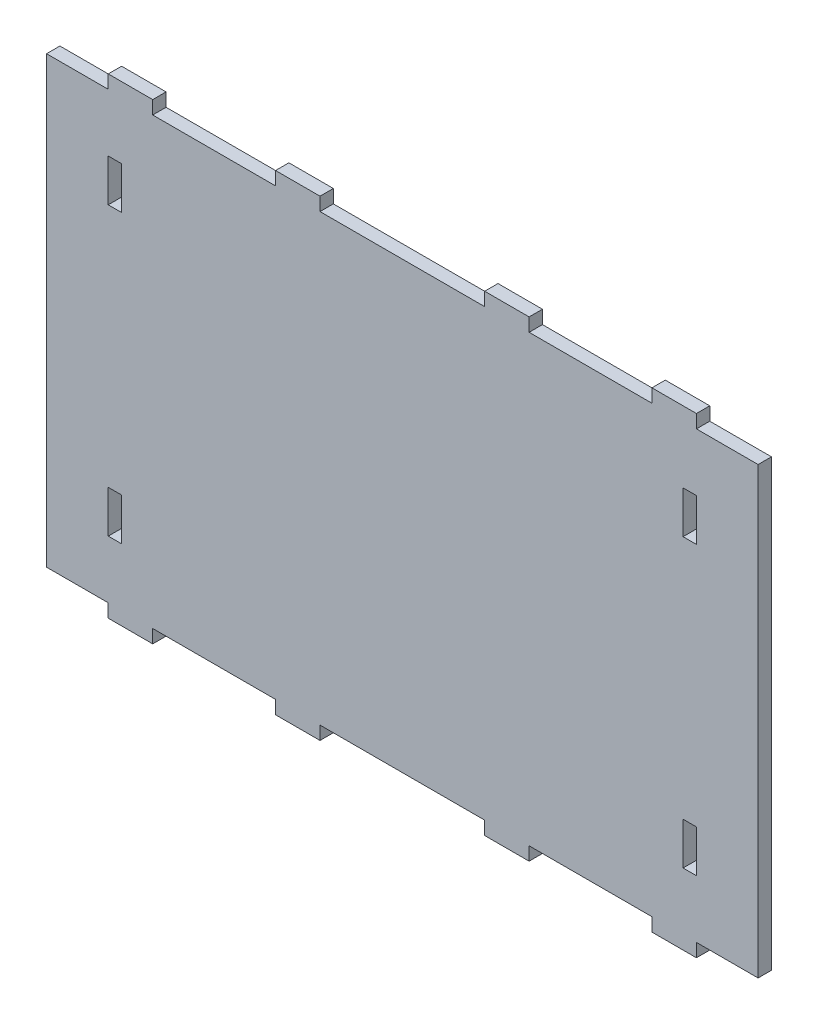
SolidWorks part; units mm, degrees
ref_plane "Plan de face" through (0, 0, 0) normal (0, 0, 1) x (1, 0, 0)
ref_plane "Plan de dessus" through (0, 0, 0) normal (0, 1, 0) x (1, 0, 0)
ref_plane "Plan de droite" through (0, 0, 0) normal (1, 0, 0) x (0, 0, -1)
sketch "Esquisse1" plane through (0, 0, 0) normal (0, 0, 1) x (1, 0, 0)
  line L0 (-80, 0) -> (-66.1305, 0)
  line L1 (-66.1305, 0) -> (-66.1305, -3)
  line L2 (-66.1305, -3) -> (-56.1305, -3)
  line L3 (-56.1305, -3) -> (-56.1305, 0)
  line L4 (-56.1305, 0) -> (-28.5112, 0)
  line L5 (-28.5112, 0) -> (-28.5112, -3)
  line L6 (-28.5112, -3) -> (-18.5112, -3)
  line L7 (-18.5112, -3) -> (-18.5112, 0)
  line L8 (-18.5112, 0) -> (18.5112, 0)
  line L9 (0, 26.5232) -> (0, -22.5938) construction
  line L10 (18.5112, -3) -> (18.5112, 0)
  line L11 (28.5112, -3) -> (18.5112, -3)
  line L12 (28.5112, 0) -> (28.5112, -3)
  line L13 (56.1305, 0) -> (28.5112, 0)
  line L14 (56.1305, -3) -> (56.1305, 0)
  line L15 (66.1305, -3) -> (56.1305, -3)
  line L16 (66.1305, 0) -> (66.1305, -3)
  line L17 (80, 0) -> (66.1305, 0)
  line L18 (-80, 0) -> (-80, 100)
  line L19 (-80, 50) -> (80, 50) construction
  line L20 (80, 100) -> (80, 0)
  line L21 (80, 100) -> (66.1305, 100)
  line L22 (66.1305, 100) -> (66.1305, 103)
  line L23 (66.1305, 103) -> (56.1305, 103)
  line L24 (56.1305, 103) -> (56.1305, 100)
  line L25 (56.1305, 100) -> (28.5112, 100)
  line L26 (28.5112, 100) -> (28.5112, 103)
  line L27 (28.5112, 103) -> (18.5112, 103)
  line L28 (18.5112, 103) -> (18.5112, 100)
  line L29 (-18.5112, 100) -> (18.5112, 100)
  line L30 (-18.5112, 103) -> (-18.5112, 100)
  line L31 (-28.5112, 103) -> (-18.5112, 103)
  line L32 (-28.5112, 100) -> (-28.5112, 103)
  line L33 (-56.1305, 100) -> (-28.5112, 100)
  line L34 (-56.1305, 103) -> (-56.1305, 100)
  line L35 (-66.1305, 103) -> (-56.1305, 103)
  line L36 (-66.1305, 100) -> (-66.1305, 103)
  line L37 (-80, 100) -> (-66.1305, 100)
  point P25 (0, 0)
  point P35 (0, 100)
  dimension "D1" = 100
extrude "Boss.-Extru.1" add sketch "Esquisse1" along normal blind 3
sketch "Esquisse2" plane through (0, 0, 3) normal (0, 0, 1) x (1, 0, 0)
  line L0 (66.1305, 12.986) -> (63.1305, 12.986) construction
  line L1 (66.1305, 22.4928) -> (66.1305, 12.986) construction
  line L2 (63.1305, 22.4928) -> (63.1305, 12.986) construction
  line L3 (66.1305, 22.4928) -> (63.1305, 22.4928) construction
  line L4 (66.1305, 12.986) -> (63.1305, 12.986)
  line L5 (66.1305, 22.4928) -> (66.1305, 12.986)
  line L6 (63.1305, 22.4928) -> (63.1305, 12.986)
  line L7 (66.1305, 22.4928) -> (63.1305, 22.4928)
  line L8 (0, 0) -> (0, 58.7412) construction
  line L9 (-66.1305, 22.4928) -> (-63.1305, 22.4928)
  line L10 (-63.1305, 22.4928) -> (-63.1305, 12.986)
  line L11 (-66.1305, 22.4928) -> (-66.1305, 12.986)
  line L12 (-66.1305, 12.986) -> (-63.1305, 12.986)
  line L13 (-80, 50) -> (80, 50) construction
  line L14 (-80, 100) -> (-80, 0) construction
  line L15 (80, 0) -> (80, 100) construction
  line L16 (66.1305, 77.5072) -> (63.1305, 77.5072)
  line L17 (63.1305, 77.5072) -> (63.1305, 87.014)
  line L18 (66.1305, 77.5072) -> (66.1305, 87.014)
  line L19 (66.1305, 87.014) -> (63.1305, 87.014)
  line L20 (-66.1305, 87.014) -> (-63.1305, 87.014)
  line L21 (-66.1305, 77.5072) -> (-66.1305, 87.014)
  line L22 (-63.1305, 77.5072) -> (-63.1305, 87.014)
  line L23 (-66.1305, 77.5072) -> (-63.1305, 77.5072)
extrude "Enlèv. mat.-Extru.1" cut sketch "Esquisse2" against normal blind 3
